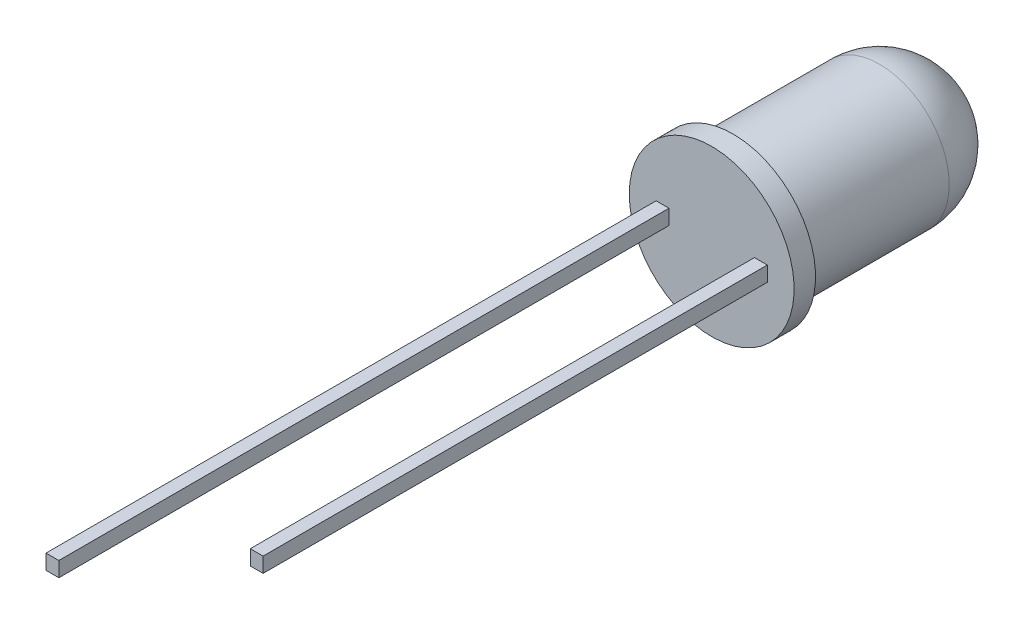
SolidWorks part; units mm, degrees
ref_plane "Front Plane" through (0, 0, 0) normal (0, 0, 1) x (1, 0, 0)
ref_plane "Top Plane" through (0, 0, 0) normal (0, 1, 0) x (1, 0, 0)
ref_plane "Right Plane" through (0, 0, 0) normal (1, 0, 0) x (0, 0, -1)
sketch "Sketch1" plane through (0, 0, 0) normal (0, 1, 0) x (1, 0, 0)
  line L0 (-0.6, 0) -> (-0.6, 30)
  line L1 (-0.6, 30) -> (-0.9213, 30)
  line L2 (-0.9213, 30) -> (-0.9213, 32)
  line L3 (-0.3645, 31.8634) -> (-0.3645, 32)
  line L4 (-0.3645, 31.8634) -> (1.4989, 30)
  line L5 (1.4989, 30) -> (0, 30)
  line L6 (0, 30) -> (0, 0)
  line L7 (0, 0) -> (-0.6, 0)
  line L8 (-0.3645, 32) -> (-0.9213, 32)
  dimension "D1" = 30
  dimension "D2" = 2
  dimension "D3" = 0.6
  dimension "D4" = 45
extrude "Boss-Extrude1" add sketch "Sketch1" along normal mid plane 0.7
sketch "Sketch2" plane through (0, 0, 0) normal (0, 1, 0) x (1, 0, 0)
  line L0 (0.2638, 32) -> (0.2638, 31.8634)
  line L1 (0.2638, 31.8634) -> (2.1272, 30)
  line L2 (2.1272, 30) -> (3.9936, 30)
  line L3 (3.9936, 30) -> (3.9936, 4.9485)
  line L4 (3.9936, 4.9485) -> (4.5936, 4.9485)
  line L5 (4.5936, 4.9485) -> (4.5936, 32)
  line L6 (4.5936, 32) -> (0.2638, 32)
  dimension "D1" = 0.6
  dimension "D2" = 135
extrude "Boss-Extrude2" add sketch "Sketch2" along normal mid plane 0.7 separate body
sketch "Sketch3" plane through (0, 0, 0) normal (0, 1, 0) x (1, 0, 0)
  line L0 (1.995, 38.6424) -> (1.995, 23.0309) construction
  line L2 (1.995, 28.5) -> (5.845, 28.5)
  line L3 (5.845, 28.5) -> (5.845, 29.5)
  line L4 (5.845, 29.5) -> (5.245, 29.5)
  line L5 (5.245, 29.5) -> (5.245, 36.3442)
  line L6 (2.1272, 30) -> (3.9936, 30) construction
  line L7 (-0.6, 30) -> (-0.6, 0) construction
  line L8 (1.995, 28.5) -> (1.995, 39.5942)
  arc A0 (5.245, 36.3442) -> (1.995, 39.5942) centre (1.995, 36.3442) ccw
  dimension "D1" = 1.5
  dimension "D2" = 1
  dimension "D3" = 6.5
  dimension "D4" = 0.6
  dimension "D5" = 2.595
revolve "Revolve1" add sketch "Sketch3" angle 360 about L0
